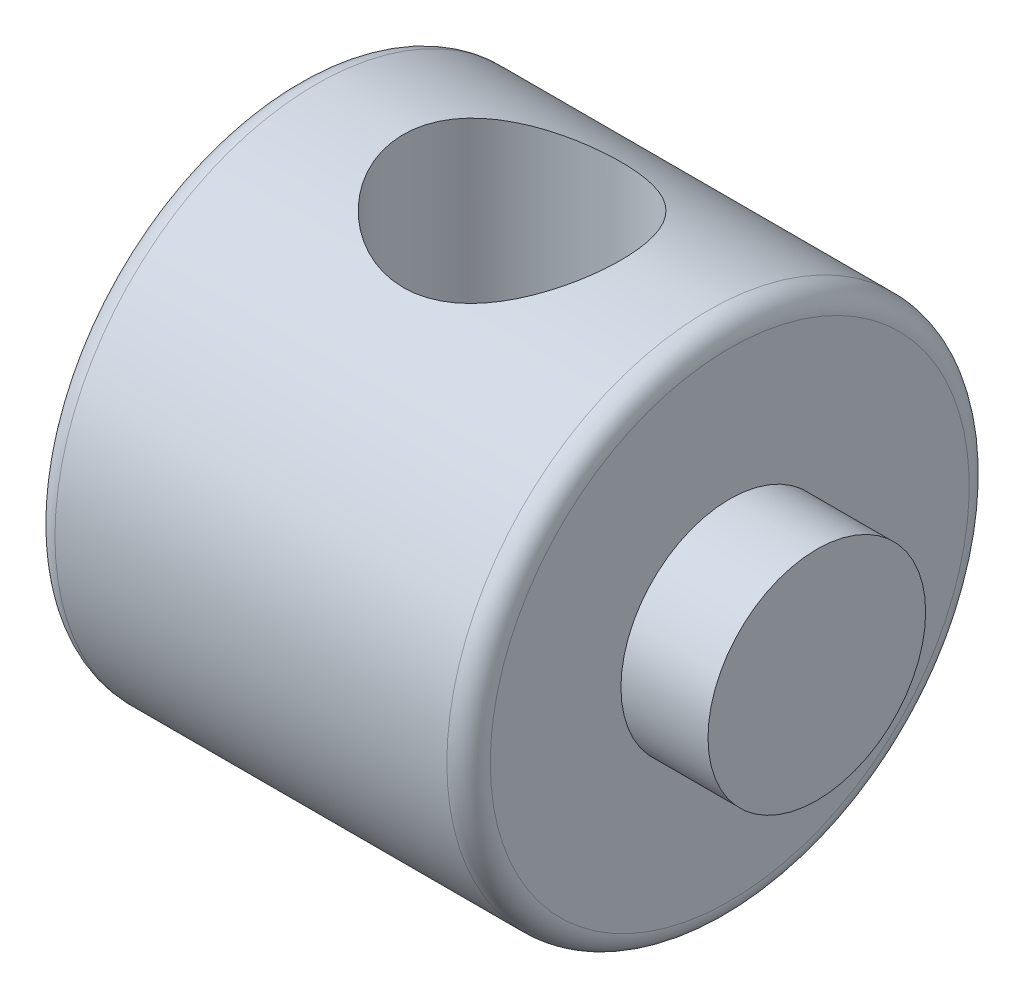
SolidWorks part; units mm, degrees
ref_plane "Front Plane" through (0, 0, 0) normal (0, 0, 1) x (1, 0, 0)
ref_plane "Top Plane" through (0, 0, 0) normal (0, 1, 0) x (1, 0, 0)
ref_plane "Right Plane" through (0, 0, 0) normal (1, 0, 0) x (0, 0, -1)
sketch "Sketch1" plane through (0, 0, 0) normal (0, 0, 1) x (1, 0, 0)
  line L0 (-11.1125, 0) -> (-11.1125, 3.9688)
  line L1 (-11.1125, 3.9688) -> (-7.9375, 3.9688)
  line L2 (-7.9375, 3.9688) -> (-7.9375, 9.525)
  line L3 (-7.9375, 9.525) -> (7.9375, 9.525)
  line L4 (7.9375, 9.525) -> (7.9375, 3.9688)
  line L5 (7.9375, 3.9688) -> (11.1125, 3.9688)
  line L6 (11.1125, 3.9688) -> (11.1125, 0)
  line L7 (11.1125, 0) -> (-11.1125, 0)
  line L8 (-58.3897, 0) -> (112.59, 0) construction
  dimension "D1" = 22.225
  dimension "D2" = 3.175
  dimension "D3" = 19.05
  dimension "D4" = 7.9375
revolve "Revolve1" add sketch "Sketch1" angle 360 about L8
fillet "Fillet1" radius 0.7925 2 edges at (-7.9375, 0, 9.525) (7.9375, 0, 9.525)
hole_wizard "3/8-16 Tapped Hole1" positions "3DSketch1" profile "Sketch2" tap size "3/8-16" standard "Ansi Inch"
sketch3d "3DSketch1"
  point P0 (0, 9.525, 0)
sketch "Sketch2" plane through (0, 9.525, 0) normal (1, 0, 0) x (0, 0, 1)
  line L0 (0, 0) -> (0, 19.05)
  line L1 (0, 19.05) -> (3.9687, 19.05)
  line L2 (3.9687, 19.05) -> (3.9687, 0)
  line L5 (3.9687, 0) -> (0, 0)
  line L11 (0, -6.35) -> (0, 107.95) construction
  dimension "Thru Tap Drill Dia." = 7.9375
  dimension "Thru Tap Drill Depth" = 19.05
